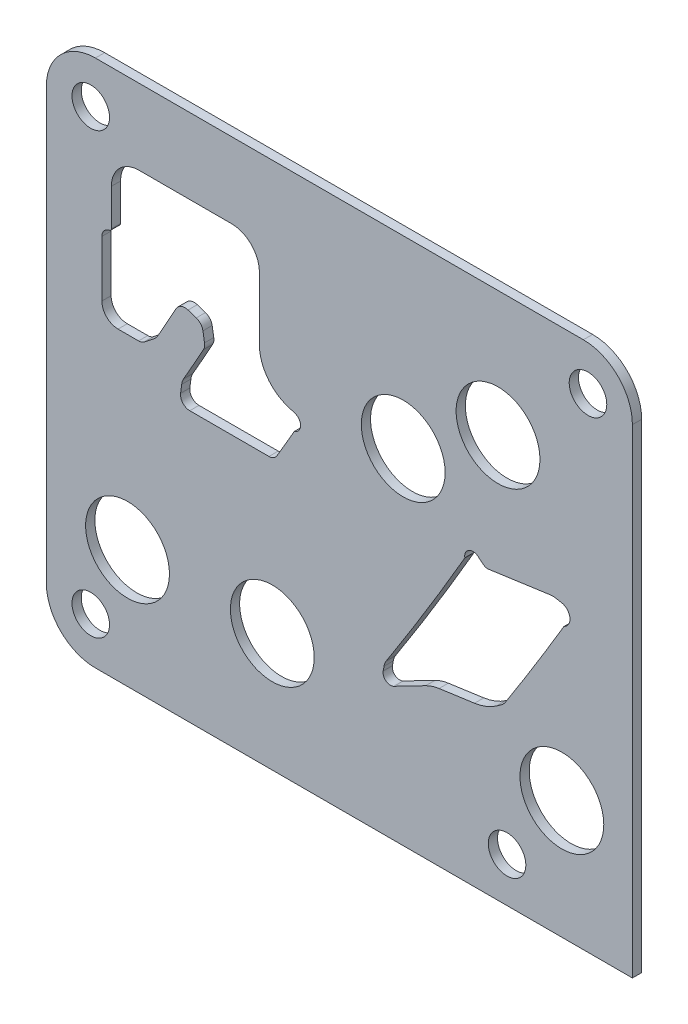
SolidWorks part; units mm, degrees
ref_plane "Front" through (0, 0, 0) normal (0, 0, 1) x (1, 0, 0)
ref_plane "Top" through (0, 0, 0) normal (0, 1, 0) x (1, 0, 0)
ref_plane "Right" through (0, 0, 0) normal (1, 0, 0) x (0, 0, -1)
ref_plane "Plane1"
sketch "Sketch1" plane through (0, 0, -29.21) normal (0, 0, 1) x (1, 0, 0)
  line L4 (-1013.5235, -19.05) -> (-865.5685, -19.05)
  line L5 (-1013.5235, -19.05) -> (-865.5685, -19.05)
  line L6 (-1027.4935, 113.03) -> (-1027.4935, -5.08)
  line L7 (-1027.4935, 113.03) -> (-1027.4935, -5.08)
  line L25 (-879.5385, 127) -> (-1013.5235, 127)
  line L30 (-879.5385, 127) -> (-1013.5235, 127)
  line L37 (-865.5685, -19.05) -> (-865.5685, 113.03)
  line L38 (-865.5685, -19.05) -> (-865.5685, 113.03)
  arc A33 (-1027.4935, -5.08) -> (-1013.5235, -19.05) centre (-1013.5235, -5.08) ccw
  arc A34 (-1027.4935, -5.08) -> (-1013.5235, -19.05) centre (-1013.5235, -5.08) ccw
  arc A35 (-1013.5235, 127) -> (-1027.4935, 113.03) centre (-1013.5235, 113.03) ccw
  arc A36 (-1013.5235, 127) -> (-1027.4935, 113.03) centre (-1013.5235, 113.03) ccw
  arc A37 (-865.5685, 113.03) -> (-879.5385, 127) centre (-879.5385, 113.03) ccw
  arc A38 (-865.5685, 113.03) -> (-879.5385, 127) centre (-879.5385, 113.03) ccw
sketch "Sketch2" plane through (0, 0, -29.21) normal (0, 0, 1) x (1, 0, 0)
  line L4 (-1013.5235, -18.542) -> (-866.0765, -18.542)
  line L5 (-1013.5235, -18.542) -> (-866.0765, -18.542)
  line L6 (-866.0765, -18.542) -> (-866.0765, 113.03)
  line L7 (-866.0765, -18.542) -> (-866.0765, 113.03)
  line L12 (-879.5385, 126.492) -> (-1013.5235, 126.492)
  line L13 (-879.5385, 126.492) -> (-1013.5235, 126.492)
  line L15 (-1026.9855, 113.03) -> (-1026.9855, -5.08)
  line L16 (-1026.9855, 113.03) -> (-1026.9855, -5.08)
  arc A6 (-866.0765, 113.03) -> (-879.5385, 126.492) centre (-879.5385, 113.03) ccw
  arc A7 (-866.0765, 113.03) -> (-879.5385, 126.492) centre (-879.5385, 113.03) ccw
  arc A12 (-1013.5235, 126.492) -> (-1026.9855, 113.03) centre (-1013.5235, 113.03) ccw
  arc A14 (-1013.5235, 126.492) -> (-1026.9855, 113.03) centre (-1013.5235, 113.03) ccw
  arc A16 (-1026.9855, -5.08) -> (-1013.5235, -18.542) centre (-1013.5235, -5.08) ccw
  arc A18 (-1026.9855, -5.08) -> (-1013.5235, -18.542) centre (-1013.5235, -5.08) ccw
extrude "Boss-Extrude1" add sketch "Sketch2" against normal blind 2.54 flip side to cut
ref_plane "Plane1 QU250515L_Punch1[Mounted in the strip]-2"
sketch "Sketch1 QU250515L_Punch1[Mounted in the strip]-2" plane through (0, 0, -29.21) normal (0, 0, 1) x (1, 0, 0)
  line L7 (-934.27, 21.5044) -> (-934.5022, 20.2462)
  line L8 (-907.0332, 59.3351) -> (-908.4015, 60.4704)
  line L9 (-888.5954, 61.2977) -> (-905.5516, 58.9147)
  line L10 (-885.5202, 60.9764) -> (-887.2049, 61.2735)
  line L11 (-903.3728, 27.4981) -> (-902.1221, 28.3689)
  line L12 (-919.1647, 23.7578) -> (-909.4114, 25.1286)
  line L13 (-931.5712, 18.0721) -> (-922.8211, 22.5935)
  line L14 (-934.27, 21.5044) -> (-934.5022, 20.2462)
  line L15 (-907.0332, 59.3351) -> (-908.4015, 60.4704)
  line L16 (-888.5954, 61.2977) -> (-905.5516, 58.9147)
  line L17 (-885.5202, 60.9764) -> (-887.2049, 61.2735)
  line L18 (-903.3728, 27.4981) -> (-902.1221, 28.3689)
  line L19 (-919.1647, 23.7578) -> (-909.4114, 25.1286)
  line L20 (-931.5712, 18.0721) -> (-922.8211, 22.5935)
  arc A13 (-933.6525, 23.0609) -> (-934.27, 21.5044) centre (-930.0237, 20.7206) ccw
  arc A14 (-933.6525, 23.0609) -> (-912.1326, 58.2596) centre (-1653.9165, 487.596) ccw
  arc A15 (-912.1326, 58.2596) -> (-912.1007, 58.4207) centre (-912.3524, 58.3868) ccw
  arc A16 (-908.4015, 60.4704) -> (-912.1007, 58.4207) centre (-909.851, 58.7234) ccw
  arc A17 (-907.0332, 59.3351) -> (-905.5516, 58.9147) centre (-905.8168, 60.8012) ccw
  arc A18 (-887.2049, 61.2735) -> (-888.5954, 61.2977) centre (-887.9768, 56.896) ccw
  arc A19 (-884.7867, 55.7106) -> (-885.5202, 60.9764) centre (-886.0054, 58.2249) ccw
  arc A20 (-884.7867, 55.7106) -> (-884.8945, 55.6115) centre (-884.6759, 55.4821) ccw
  arc A21 (-900.9562, 29.5792) -> (-884.8945, 55.6115) centre (-1614.1655, 487.596) ccw
  arc A22 (-902.1221, 28.3689) -> (-900.9562, 29.5792) centre (-904.5895, 31.9125) ccw
  arc A23 (-909.4114, 25.1286) -> (-903.3728, 27.4981) centre (-911.3556, 38.9626) ccw
  arc A24 (-919.1647, 23.7578) -> (-922.8211, 22.5935) centre (-917.574, 12.4391) ccw
  arc A25 (-934.5022, 20.2462) -> (-931.5712, 18.0721) centre (-932.504, 19.8773) ccw
  arc A26 (-933.6525, 23.0609) -> (-934.27, 21.5044) centre (-930.0237, 20.7206) ccw
  arc A27 (-933.6525, 23.0609) -> (-912.1326, 58.2596) centre (-1653.9165, 487.596) ccw
  arc A28 (-912.1326, 58.2596) -> (-912.1007, 58.4207) centre (-912.3524, 58.3868) ccw
  arc A29 (-908.4015, 60.4704) -> (-912.1007, 58.4207) centre (-909.851, 58.7234) ccw
  arc A30 (-907.0332, 59.3351) -> (-905.5516, 58.9147) centre (-905.8168, 60.8012) ccw
  arc A31 (-887.2049, 61.2735) -> (-888.5954, 61.2977) centre (-887.9768, 56.896) ccw
  arc A32 (-884.7867, 55.7106) -> (-885.5202, 60.9764) centre (-886.0054, 58.2249) ccw
  arc A33 (-884.7867, 55.7106) -> (-884.8945, 55.6115) centre (-884.6759, 55.4821) ccw
  arc A34 (-900.9562, 29.5792) -> (-884.8945, 55.6115) centre (-1614.1655, 487.596) ccw
  arc A35 (-902.1221, 28.3689) -> (-900.9562, 29.5792) centre (-904.5895, 31.9125) ccw
  arc A36 (-909.4114, 25.1286) -> (-903.3728, 27.4981) centre (-911.3556, 38.9626) ccw
  arc A37 (-919.1647, 23.7578) -> (-922.8211, 22.5935) centre (-917.574, 12.4391) ccw
  arc A38 (-934.5022, 20.2462) -> (-931.5712, 18.0721) centre (-932.504, 19.8773) ccw
hole_wizard "Hole1" positions "Point_Sketch" profile "Profil_Sketch" hole size "Ø0.15" standard "ISO"
sketch "Point_Sketch" plane through (-1008.3513, 24.5711, -29.21) normal (0, 0, -1) x (1, 0, 0)
  point P0 (3.6543, 10.6011)
  point P2 (43.4053, 10.6011)
  point P4 (122.9073, 10.6011)
  point P6 (79.3463, -51.3241)
  point P8 (105.3813, -67.5039)
sketch "Profil_Sketch" plane through (-1004.697, 13.97, -29.21) normal (1, 0, 0) x (0, -1, 0)
  line L0 (0, 0) -> (0, 2.54)
  line L1 (0, 2.54) -> (11.5094, 2.54)
  line L2 (11.5094, 2.54) -> (11.5094, 0)
  line L5 (11.5094, 0) -> (0, 0)
  line L11 (0, -6.35) -> (0, 107.95) construction
  dimension "Diameter" = 23.0188
  dimension "Thru Hole Depth" = 2.54
other "usin_DL090<1>"
ref_plane "Plane1 QU250515L_Punch4[Mounted in the strip]-1"
sketch "Sketch1 QU250515L_Punch4[Mounted in the strip]-1" plane through (0, 0, -29.21) normal (0, 0, 1) x (1, 0, 0)
  line L10 (-987.6114, 55.5835) -> (-965.8621, 55.5835)
  line L11 (-989.8349, 60.7285) -> (-990.1303, 58.4501)
  line L12 (-983.9933, 76.3899) -> (-983.5577, 73.7415)
  line L13 (-988.0833, 79.2868) -> (-985.8271, 78.5379)
  line L14 (-1000.1, 65.6885) -> (-997.4742, 67.7374)
  line L15 (-1004.697, 65.151) -> (-1001.6626, 65.151)
  line L16 (-1009.142, 98.171) -> (-1009.142, 69.596)
  line L17 (-976.122, 105.791) -> (-1001.522, 105.791)
  line L18 (-968.502, 80.8774) -> (-968.502, 98.171)
  line L19 (-958.7818, 69.4447) -> (-960.4329, 69.9527)
  line L20 (-987.6114, 55.5835) -> (-965.8621, 55.5835)
  line L21 (-989.8349, 60.7285) -> (-990.1303, 58.4501)
  line L22 (-983.9933, 76.3899) -> (-983.5577, 73.7415)
  line L23 (-988.0833, 79.2868) -> (-985.8271, 78.5379)
  line L24 (-1000.1, 65.6885) -> (-997.4742, 67.7374)
  line L25 (-1004.697, 65.151) -> (-1001.6626, 65.151)
  line L26 (-1009.142, 98.171) -> (-1009.142, 69.596)
  line L27 (-976.122, 105.791) -> (-1001.522, 105.791)
  line L28 (-968.502, 80.8774) -> (-968.502, 98.171)
  line L29 (-958.7818, 69.4447) -> (-960.4329, 69.9527)
  arc A17 (-990.1303, 58.4501) -> (-987.6114, 55.5835) centre (-987.6114, 58.1235) ccw
  arc A18 (-989.3016, 62.3158) -> (-989.8349, 60.7285) centre (-985.5527, 60.1732) ccw
  arc A19 (-989.3016, 62.3158) -> (-983.864, 71.9746) centre (-1733.4185, 487.596) ccw
  arc A20 (-983.864, 71.9746) -> (-983.5577, 73.7415) centre (-986.2515, 73.2984) ccw
  arc A21 (-983.9933, 76.3899) -> (-985.8271, 78.5379) centre (-986.6871, 75.9469) ccw
  arc A22 (-988.0833, 79.2868) -> (-991.3335, 78.015) centre (-988.9433, 76.6958) ccw
  arc A23 (-996.3758, 69.0093) -> (-991.3335, 78.015) centre (-1733.4185, 487.596) ccw
  arc A24 (-997.4742, 67.7374) -> (-996.3758, 69.0093) centre (-1000.1305, 71.1417) ccw
  arc A25 (-1001.6626, 65.151) -> (-1000.1, 65.6885) centre (-1001.6626, 67.691) ccw
  arc A26 (-1009.142, 69.596) -> (-1004.697, 65.151) centre (-1004.697, 69.596) ccw
  arc A27 (-1001.522, 105.791) -> (-1009.142, 98.171) centre (-1001.522, 98.171) ccw
  arc A28 (-968.502, 98.171) -> (-976.122, 105.791) centre (-976.122, 98.171) ccw
  arc A29 (-968.502, 80.8774) -> (-960.4329, 69.9527) centre (-957.072, 80.8774) ccw
  arc A30 (-958.7764, 65.1071) -> (-958.7818, 69.4447) centre (-959.4493, 67.2751) ccw
  arc A31 (-958.7764, 65.1071) -> (-958.9213, 64.9912) centre (-958.7011, 64.8645) ccw
  arc A32 (-963.6745, 56.8326) -> (-958.9213, 64.9912) centre (-1693.6675, 487.596) ccw
  arc A33 (-965.8621, 55.5835) -> (-963.6745, 56.8326) centre (-965.8621, 58.1235) ccw
  arc A34 (-990.1303, 58.4501) -> (-987.6114, 55.5835) centre (-987.6114, 58.1235) ccw
  arc A35 (-989.3016, 62.3158) -> (-989.8349, 60.7285) centre (-985.5527, 60.1732) ccw
  arc A36 (-989.3016, 62.3158) -> (-983.864, 71.9746) centre (-1733.4185, 487.596) ccw
  arc A37 (-983.864, 71.9746) -> (-983.5577, 73.7415) centre (-986.2515, 73.2984) ccw
  arc A38 (-983.9933, 76.3899) -> (-985.8271, 78.5379) centre (-986.6871, 75.9469) ccw
  arc A39 (-988.0833, 79.2868) -> (-991.3335, 78.015) centre (-988.9433, 76.6958) ccw
  arc A40 (-996.3758, 69.0093) -> (-991.3335, 78.015) centre (-1733.4185, 487.596) ccw
  arc A41 (-997.4742, 67.7374) -> (-996.3758, 69.0093) centre (-1000.1305, 71.1417) ccw
  arc A42 (-1001.6626, 65.151) -> (-1000.1, 65.6885) centre (-1001.6626, 67.691) ccw
  arc A43 (-1009.142, 69.596) -> (-1004.697, 65.151) centre (-1004.697, 69.596) ccw
  arc A44 (-1001.522, 105.791) -> (-1009.142, 98.171) centre (-1001.522, 98.171) ccw
  arc A45 (-968.502, 98.171) -> (-976.122, 105.791) centre (-976.122, 98.171) ccw
  arc A46 (-968.502, 80.8774) -> (-960.4329, 69.9527) centre (-957.072, 80.8774) ccw
  arc A47 (-958.7764, 65.1071) -> (-958.7818, 69.4447) centre (-959.4493, 67.2751) ccw
  arc A48 (-958.7764, 65.1071) -> (-958.9213, 64.9912) centre (-958.7011, 64.8645) ccw
  arc A49 (-963.6745, 56.8326) -> (-958.9213, 64.9912) centre (-1693.6675, 487.596) ccw
  arc A50 (-965.8621, 55.5835) -> (-963.6745, 56.8326) centre (-965.8621, 58.1235) ccw
hole_wizard "Hole11" positions "Point_Sketch1" profile "Profil_Sketch1" hole size "Ø0.15" standard "ISO"
sketch "Point_Sketch1" plane through (-904.1478, 10.6011, -29.21) normal (0, 0, -1) x (1, 0, 0)
  point P0 (3.6543, 16.9511)
  point P2 (25.8793, -103.6989)
  point P4 (-110.6457, -103.6989)
  point P6 (-110.6457, 16.9511)
sketch "Profil_Sketch1" plane through (-900.4935, -6.35, -29.21) normal (1, 0, 0) x (0, -1, 0)
  line L0 (0, 0) -> (0, 2.54)
  line L1 (0, 2.54) -> (5.1562, 2.54)
  line L2 (5.1562, 2.54) -> (5.1562, 0)
  line L5 (5.1562, 0) -> (0, 0)
  line L11 (0, -6.35) -> (0, 107.95) construction
  dimension "Diameter" = 10.3124
  dimension "Thru Hole Depth" = 2.54
other "usin_DL090_.375-16x1.75-SHCS<2>"
extrude "Cut-Extrude1 QU250515L_Punch1[Mounted in the strip]-2" cut sketch "Sketch1 QU250515L_Punch1[Mounted in the strip]-2" against normal through all
extrude "Cut-Extrude1 QU250515L_Punch4[Mounted in the strip]-1" cut sketch "Sketch1 QU250515L_Punch4[Mounted in the strip]-1" against normal through all
sketch "Sketch3" plane through (0, 0, -29.21) normal (0, 0, 1) x (1, 0, 0)
  line L7 (-1004.697, 65.151) -> (-1001.6626, 65.151) construction
  line L10 (-1011.743, 84.963) -> (-1011.743, 69.596)
  line L11 (-1011.743, 84.963) -> (-1011.743, 69.596)
  line L12 (-1009.142, 98.171) -> (-1009.142, 69.596) construction
  line L13 (-1004.697, 65.151) -> (-1007.298, 65.151)
  line L14 (-1009.142, 88.0857) -> (-1009.142, 69.596)
  arc A11 (-1009.142, 69.596) -> (-1004.697, 65.151) centre (-1004.697, 69.596) ccw construction
  arc A16 (-1009.142, 69.596) -> (-1004.697, 65.151) centre (-1004.697, 69.596) ccw
  arc A18 (-1009.6643, 87.4586) -> (-1009.142, 88.0857) centre (-1009.7795, 88.0857) ccw
  arc A19 (-1009.6643, 87.4586) -> (-1011.743, 84.963) centre (-1009.2055, 84.963) ccw
  arc A20 (-1011.743, 69.596) -> (-1007.298, 65.151) centre (-1007.298, 69.596) ccw
  arc A21 (-1009.6643, 87.4586) -> (-1009.142, 88.0857) centre (-1009.7795, 88.0857) ccw
  arc A22 (-1009.6643, 87.4586) -> (-1011.743, 84.963) centre (-1009.2055, 84.963) ccw
  arc A23 (-1011.743, 69.596) -> (-1007.298, 65.151) centre (-1007.298, 69.596) ccw
  dimension "D1" = 0.95
extrude "Cut-Extrude1" cut sketch "Sketch3" against normal through all
